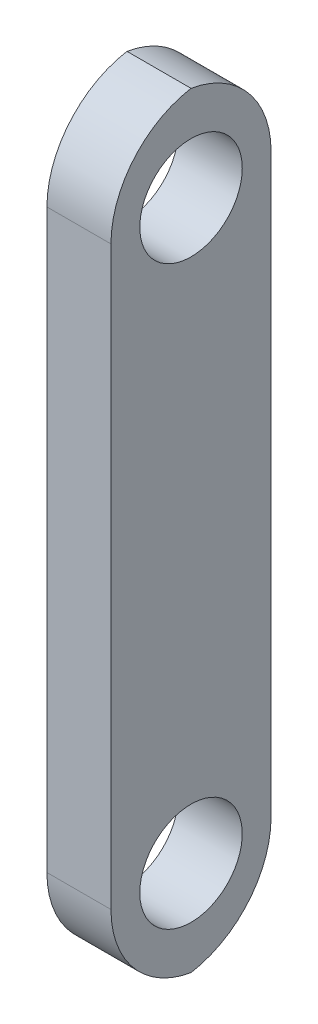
SolidWorks part; units mm, degrees
ref_plane "Front Plane" through (0, 0, 0) normal (0, 0, 1) x (1, 0, 0)
ref_plane "Top Plane" through (0, 0, 0) normal (0, 1, 0) x (1, 0, 0)
ref_plane "Right Plane" through (0, 0, 0) normal (1, 0, 0) x (0, 0, -1)
sketch "Sketch2" plane through (0, 0, 0) normal (1, 0, 0) x (0, 0, -1)
  line L0 (2.1022, 0) -> (7.1022, 0)
  line L1 (7.1022, 0) -> (7.1022, -24)
  line L2 (7.1022, -24) -> (2.1022, -24)
  line L3 (2.1022, -24) -> (2.1022, 0)
  dimension "D1" = 2.1022
  dimension "28" = 24
  dimension "D2" = 5
  dimension "D3" = 7.1022
extrude "Boss-Extrude1" add sketch "Sketch2" along normal blind 2
sketch "Sketch3" plane through (2, 0, 0) normal (1, 0, 0) x (0, 0, -1)
  line L0 (4.6022, 0) -> (4.6022, -24) construction
  line L1 (7.1022, 0) -> (2.1022, 0) construction
  line L2 (2.1022, -24) -> (7.1022, -24) construction
  line L3 (2.1022, 0) -> (2.1022, -3) construction
  line L4 (2.1022, 0) -> (2.1022, -24) construction
  line L5 (2.1022, -3) -> (4.6022, -3) construction
  line L6 (2.1022, -12) -> (7.1022, -12) construction
  line L7 (7.1022, -24) -> (7.1022, 0) construction
  circle A0 centre (4.6022, -3) radius 1.6
  circle A1 centre (4.6022, -21) radius 1.6
  dimension "D2" = 3.2
  dimension "D1" = 3
extrude "Cut-Extrude1" cut sketch "Sketch3" against normal blind 4
fillet "Fillet1" radius 3 4 edges at (1, -24, -7.1022) (1, -24, -2.1022) (1, 0, -2.1022) (1, 0, -7.1022)
